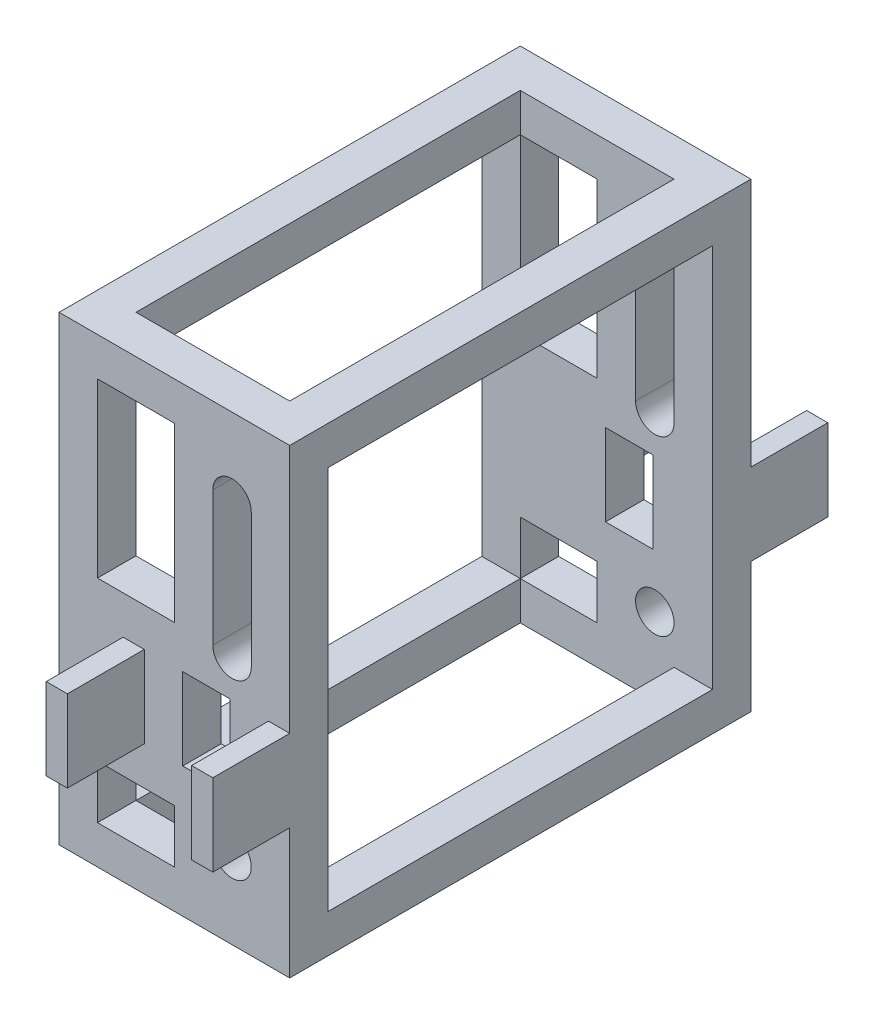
SolidWorks part; units mm, degrees
ref_plane "Front Plane" through (0, 0, 0) normal (0, 0, 1) x (1, 0, 0)
ref_plane "Top Plane" through (0, 0, 0) normal (0, 1, 0) x (1, 0, 0)
ref_plane "Right Plane" through (0, 0, 0) normal (1, 0, 0) x (0, 0, -1)
sketch "Sketch1" plane through (0, 0, 0) normal (0, 0, 1) x (1, 0, 0)
  line L1 (0, 0) -> (76.2, 0)
  line L2 (0, 0) -> (0, 152.4)
  line L3 (0, 152.4) -> (76.2, 152.4)
  line L4 (76.2, 0) -> (76.2, 152.4)
  dimension "D1" = 76.2
  dimension "D2" = 152.4
extrude "Boss-Extrude1" add sketch "Sketch1" along normal blind 152.4
sketch "Sketch2" plane through (0, 152.4, 0) normal (0, 1, 0) x (1, 0, 0)
  line L0 (76.2, 0) -> (0, 0) construction
  line L1 (12.7, -12.7) -> (63.5, -12.7)
  line L2 (12.7, -12.7) -> (12.7, -139.7)
  line L3 (12.7, -139.7) -> (63.5, -139.7)
  line L4 (63.5, -12.7) -> (63.5, -139.7)
  line L5 (76.2, -152.4) -> (76.2, 0) construction
  line L6 (0, -152.4) -> (0, 0) construction
  line L7 (76.2, -152.4) -> (0, -152.4) construction
  dimension "D1" = 12.7
  dimension "D2" = 12.7
  dimension "D3" = 12.7
  dimension "D4" = 12.7
extrude "Cut-Extrude1" cut sketch "Sketch2" against normal through all
sketch "Sketch3" plane through (76.2, 0, 0) normal (1, 0, 0) x (0, 0, -1)
  line L0 (-152.4, 152.4) -> (0, 152.4) construction
  line L1 (-139.7, 139.7) -> (-12.7, 139.7)
  line L2 (-139.7, 139.7) -> (-139.7, 12.7)
  line L3 (-139.7, 12.7) -> (-12.7, 12.7)
  line L4 (-12.7, 139.7) -> (-12.7, 12.7)
  line L5 (0, 0) -> (0, 152.4) construction
  line L6 (-152.4, 0) -> (0, 0) construction
  line L7 (-152.4, 0) -> (-152.4, 152.4) construction
  dimension "D1" = 12.7
  dimension "D2" = 12.7
  dimension "D3" = 12.7
  dimension "D4" = 12.7
extrude "Cut-Extrude2" cut sketch "Sketch3" against normal through all
sketch "Sketch4" plane through (0, 0, 152.4) normal (0, 0, 1) x (1, 0, 0)
  line L0 (76.2, 0) -> (76.2, 152.4) construction
  line L1 (69.2, 70) -> (76.2, 70)
  line L2 (69.2, 70) -> (69.2, 43)
  line L3 (69.2, 43) -> (76.2, 43)
  line L4 (76.2, 70) -> (76.2, 43)
  line L5 (28.15, 70) -> (21.15, 70)
  line L6 (28.15, 70) -> (28.15, 43)
  line L7 (28.15, 43) -> (21.15, 43)
  line L8 (21.15, 70) -> (21.15, 43)
  line L9 (0, 0) -> (76.2, 0) construction
  dimension "D1" = 27
  dimension "D2" = 7
  dimension "D3" = 41.05
  dimension "D4" = 70
extrude "Boss-Extrude2" add sketch "Sketch4" along normal blind 25.4
ref_plane "Plane1" through (0, 0, 76.2) normal (0, 0, 1) x (1, 0, 0)
mirror "Mirror1" about plane through (0, 0, 76.2) normal (0, 0, 1) of "Boss-Extrude2"
sketch "Sketch5" plane through (0, 0, 152.4) normal (0, 0, 1) x (1, 0, 0)
  line L0 (50.8, 127) -> (50.8, 82.55)
  line L1 (63.5, 127) -> (63.5, 82.55)
  line L2 (0, 0) -> (76.2, 0) construction
  line L3 (76.2, 70) -> (76.2, 152.4) construction
  line L4 (76.2, 152.4) -> (0, 152.4) construction
  arc A0 (63.5, 127) -> (50.8, 127) centre (57.15, 127) ccw
  arc A1 (50.8, 82.55) -> (63.5, 82.55) centre (57.15, 82.55) ccw
  circle A2 centre (57.15, 25.4) radius 6.35
  dimension "D1" = 12.7
  dimension "D2" = 25.4
  dimension "D3" = 19.05
  dimension "D4" = 44.45
  dimension "D5" = 25.4
extrude "Cut-Extrude3" cut sketch "Sketch5" against normal through all
sketch "Sketch6" plane through (0, 0, 152.4) normal (0, 0, 1) x (1, 0, 0)
  line L0 (76.2, 152.4) -> (0, 152.4) construction
  line L1 (12.7, 139.7) -> (38.1, 139.7)
  line L2 (12.7, 139.7) -> (12.7, 82.7)
  line L3 (12.7, 82.7) -> (38.1, 82.7)
  line L4 (38.1, 139.7) -> (38.1, 82.7)
  line L5 (0, 152.4) -> (0, 0) construction
  line L6 (28.15, 70) -> (21.15, 70) construction
  line L7 (50.8, 127) -> (50.8, 82.55) construction
  line L8 (21.15, 43) -> (28.15, 43) construction
  line L9 (40.85, 70) -> (56.5, 70)
  line L10 (40.85, 70) -> (40.85, 43)
  line L11 (40.85, 43) -> (56.5, 43)
  line L12 (56.5, 70) -> (56.5, 43)
  line L13 (76.2, 70) -> (69.2, 70) construction
  line L14 (28.15, 43) -> (28.15, 70) construction
  line L15 (69.2, 70) -> (69.2, 43) construction
  line L16 (0, 0) -> (76.2, 0) construction
  line L17 (12.7, 30.3) -> (38.1, 30.3)
  line L18 (12.7, 30.3) -> (12.7, 12.7)
  line L19 (12.7, 12.7) -> (38.1, 12.7)
  line L20 (38.1, 30.3) -> (38.1, 12.7)
  dimension "D1" = 12.7
  dimension "D2" = 12.7
  dimension "D3" = 12.7
  dimension "D4" = 12.7
  dimension "D5" = 12.7
  dimension "D6" = 12.7
  dimension "D7" = 12.7
  dimension "D8" = 12.7
extrude "Cut-Extrude4" cut sketch "Sketch6" against normal through all
